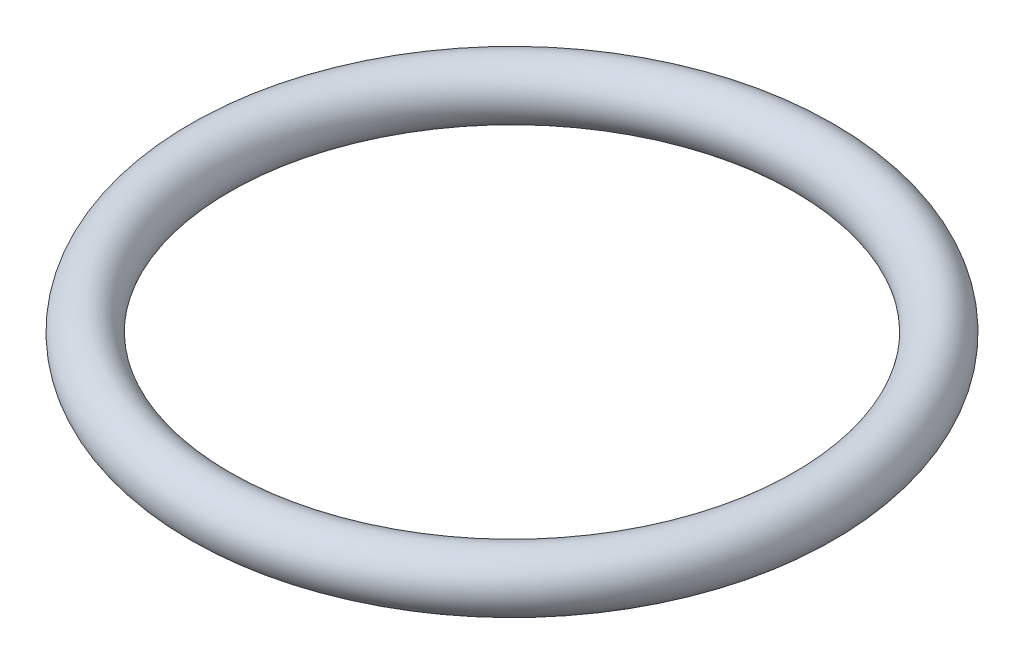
SolidWorks part; units mm, degrees
ref_plane "Plan de face" through (0, 0, 0) normal (0, 0, 1) x (1, 0, 0)
ref_plane "Plan de dessus" through (0, 0, 0) normal (0, 1, 0) x (1, 0, 0)
ref_plane "Plan de droite" through (0, 0, 0) normal (1, 0, 0) x (0, 0, -1)
sketch "Esquisse1" plane through (0, 0, 0) normal (0, 0, 1) x (1, 0, 0)
  line L0 (0, 0) -> (-17.8, 0) construction
  line L1 (0, 0) -> (0, 23.74) construction
  circle A0 centre (-19.6, 0) radius 1.8
  dimension "D2" = 3.6
  dimension "D1" = 35.6
revolve "Révolution1" add sketch "Esquisse1" angle 360 about L1
